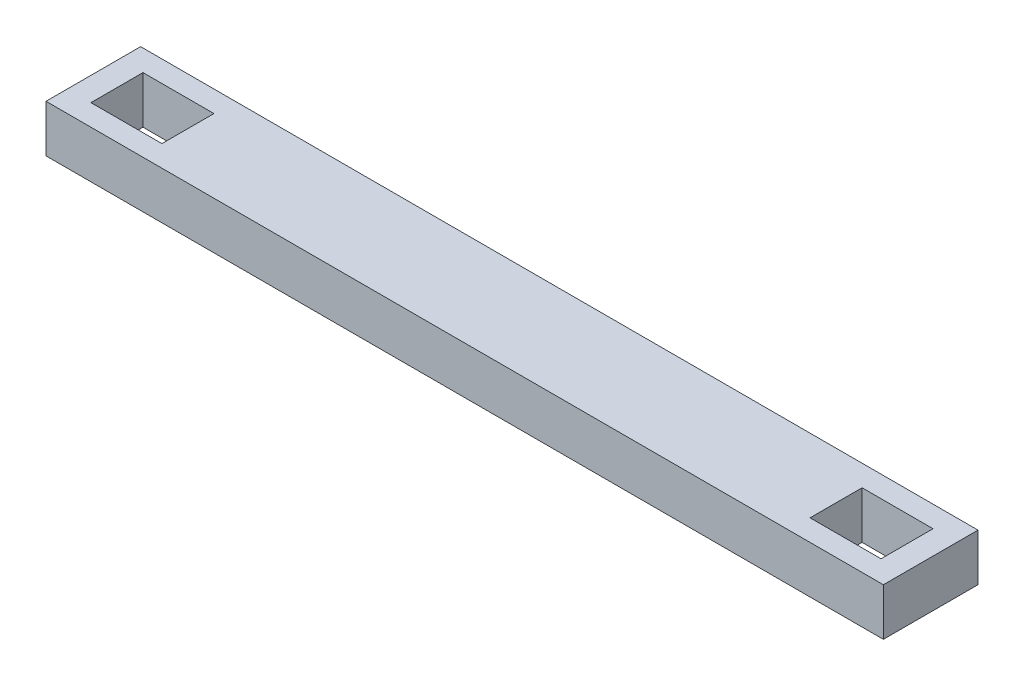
SolidWorks part; units mm, degrees
ref_plane "Front Plane" through (0, 0, 0) normal (0, 0, 1) x (1, 0, 0)
ref_plane "Top Plane" through (0, 0, 0) normal (0, 1, 0) x (1, 0, 0)
ref_plane "Right Plane" through (0, 0, 0) normal (1, 0, 0) x (0, 0, -1)
sketch "Sketch1" plane through (0, 0, 0) normal (0, 1, 0) x (1, 0, 0)
  line L0 (76, -10) -> (76, -28.6395) construction
  line L1 (-12.5, 10) -> (12.5, 10)
  line L2 (-12.5, 10) -> (-12.5, -10)
  line L3 (-12.5, -10) -> (12.5, -10)
  line L4 (12.5, 10) -> (12.5, -10)
  line L5 (-12.5, 10) -> (12.5, -10) construction
  line L6 (-12.5, -10) -> (12.5, 10) construction
  line L7 (-7.5, 5.5) -> (7.5, 5.5)
  line L8 (-7.5, 5.5) -> (-7.5, -5.5)
  line L9 (-7.5, -5.5) -> (7.5, -5.5)
  line L10 (7.5, 5.5) -> (7.5, -5.5)
  line L11 (-7.5, 5.5) -> (7.5, -5.5) construction
  line L12 (-7.5, -5.5) -> (7.5, 5.5) construction
  line L13 (12.5, 10) -> (139.5, 10)
  line L14 (12.5, 10) -> (12.5, -10)
  line L15 (12.5, -10) -> (139.5, -10)
  line L16 (139.5, 10) -> (139.5, -10)
  line L17 (159.5, -5.5) -> (144.5, 5.5) construction
  line L18 (159.5, 5.5) -> (144.5, -5.5) construction
  line L19 (164.5, -10) -> (139.5, 10) construction
  line L20 (164.5, 10) -> (139.5, -10) construction
  line L21 (139.5, 10) -> (139.5, -10)
  line L22 (144.5, 5.5) -> (144.5, -5.5)
  line L23 (159.5, -5.5) -> (144.5, -5.5)
  line L24 (159.5, 5.5) -> (159.5, -5.5)
  line L25 (159.5, 5.5) -> (144.5, 5.5)
  line L26 (139.5, 10) -> (139.5, -10)
  line L27 (164.5, -10) -> (139.5, -10)
  line L28 (164.5, 10) -> (164.5, -10)
  line L29 (164.5, 10) -> (139.5, 10)
  point P0 (0, 0)
  point P6 (0, 0)
  point P21 (152, 0)
  dimension "D1" = 15
  dimension "D2" = 11
  dimension "D3" = 20
  dimension "D4" = 25
  dimension "D5" = 127
extrude "Boss-Extrude1" add sketch "Sketch1" along normal blind 10 contours L4 L1 L2 L3 L7 L10 L9 L8 | L16 L13 L4 L15 | L28 L29 L16 L27 L25 L24 L23 L22
